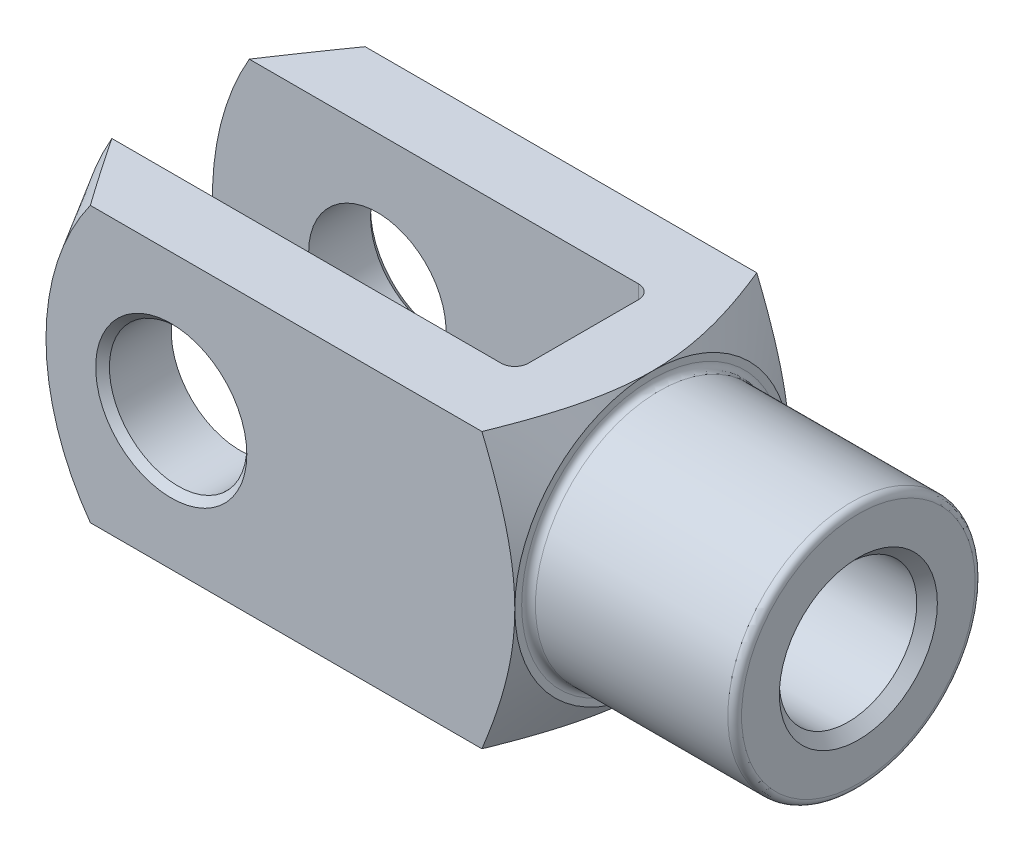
SolidWorks part; units mm, degrees
ref_plane "Front Plane" through (0, 0, 0) normal (0, 0, 1) x (1, 0, 0)
ref_plane "Top Plane" through (0, 0, 0) normal (0, 1, 0) x (1, 0, 0)
ref_plane "Right Plane" through (0, 0, 0) normal (1, 0, 0) x (0, 0, -1)
sketch "Sketch1" plane through (0, 0, 0) normal (1, 0, 0) x (0, 0, -1)
  line L0 (0, 0) -> (0, 50000) construction
  line L1 (0, 0) -> (50000, 0) construction
  line L2 (-10, -10) -> (-10, 10)
  line L3 (-10, 10) -> (10, 10)
  line L4 (10, -10) -> (10, 10)
  line L5 (-10, -10) -> (10, -10)
  point P9 (0, 10)
  point P11 (10, 0)
  point P12 (-10, 0)
  dimension "D1" = 20
  dimension "D2" = 20
extrude "Extrude1" add sketch "Sketch1" against normal blind 52
sketch "Sketch2" plane through (0, 0, 0) normal (1, 0, 0) x (0, 0, -1)
  circle A0 centre (0, 0) radius 9
  circle A1 centre (0, 0) radius 18
  dimension "D1" = 18
  dimension "D2" = 36
extrude "Extrude2" cut sketch "Sketch2" against normal blind 15
sketch "Sketch3" plane through (0, 0, 10) normal (0, 0, 1) x (1, 0, 0)
  circle A0 centre (-40, 0) radius 5
  dimension "D1" = 10
  dimension "D2" = 40
extrude "Extrude3" cut sketch "Sketch3" against normal through all
sketch "Sketch4" plane through (0, 10, 0) normal (0, 1, 0) x (1, 0, 0)
  line L0 (0, 0) -> (-50000, 0) construction
  line L1 (-52, -5) -> (-52, 5)
  line L2 (-52, 10) -> (-52, -10) construction
  line L3 (-52, 5) -> (-20, 5)
  line L4 (-20, 5) -> (-20, -5)
  line L5 (-40, 10) -> (-40, -10) construction
  line L6 (-52, -5) -> (-20, -5)
  point P7 (-40, 0)
  point P13 (-20, 0)
  point P14 (-52, 0)
  dimension "D1" = 20
  dimension "D2" = 10
extrude "Extrude4" cut sketch "Sketch4" against normal through all
fillet "Fillet1" radius 1 2 edges at (-20, 0, 5) (-20, 0, -5)
fillet "Fillet2" radius 0.5 2 edges at (0, 0, -9) (-15, 0, -9)
chamfer "Chamfer2" distance 0.5 angle 45 2 edges at (-35, 0, -10) (-35, 0, 10)
sketch "Sketch6" plane through (0, 0, 0) normal (0, 0, 1) x (1, 0, 0)
  line L0 (-15, -10) -> (-15, -20)
  line L1 (-15, -20) -> (-20.7735, -20)
  line L2 (-20.7735, -20) -> (-15, -10)
  dimension "D1" = 30
  dimension "D2" = 20
revolve "Cut-Revolve1" cut sketch "Sketch6" angle 360 about axis through (-15, 0, 0) along (1, 0, 0)
sketch "Sketch7" plane through (0, 0, 0) normal (0, 1, 0) x (1, 0, 0)
  line L0 (-49.1132, -10) -> (-52, -5)
  line L1 (-52, 5) -> (-49.1132, 10)
  line L2 (-49.1132, 10) -> (-72, 10)
  line L3 (-52, 5) -> (-52, -5)
  line L4 (-72, 10) -> (-72, -10)
  line L5 (-72, -10) -> (-49.1132, -10)
  line L6 (-52, 10) -> (-17.3915, 10) construction
  line L7 (-52, -10) -> (-17.3915, -10) construction
  line L8 (-32, 0.6162) -> (-32, 50000.6162) construction
  dimension "D1" = 120
  dimension "D2" = 20
  dimension "D3" = 20
revolve "Cut-Revolve2" cut sketch "Sketch7" angle 180 about L8
sketch "Sketch8" plane through (0, 0, 0) normal (1, 0, 0) x (0, 0, -1)
  circle A0 centre (0, 0) radius 5
  dimension "D1" = 10
extrude "Extrude5" cut sketch "Sketch8" against normal through all
chamfer "Chamfer3" distance 0.75 angle 45 1 edges at (0, 0, -5)
equation "\"D2@Sketch1\" = \"D1@Sketch1\""
equation "\"D2@Sketch2\" = \"D1@Sketch2\"*2"
equation "\"D2@Sketch6\" = \"D1@Sketch1\""
equation "\"D2@Sketch7\" = \"D1@Sketch1\""
equation "\"D3@Sketch7\" = \"D1@Sketch1\""
